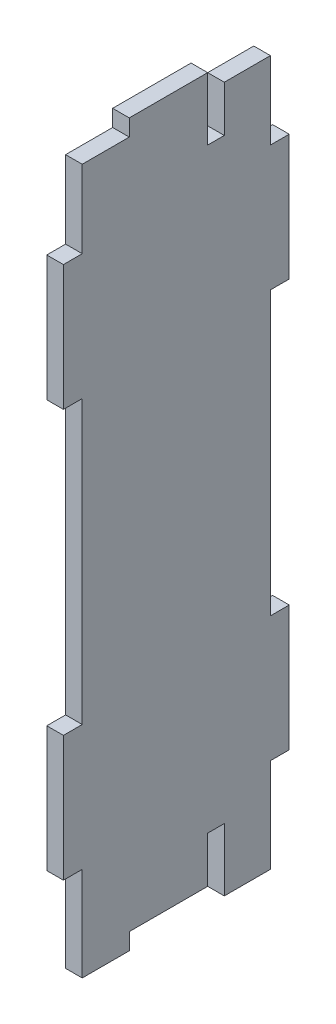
SolidWorks part; units mm, degrees
ref_plane "Alzado" through (0, 0, 0) normal (0, 0, 1) x (1, 0, 0)
ref_plane "Planta" through (0, 0, 0) normal (0, 1, 0) x (1, 0, 0)
ref_plane "Vista lateral" through (0, 0, 0) normal (1, 0, 0) x (0, 0, -1)
sketch "Croquis1" plane through (0, 0, 0) normal (0, 0, 1) x (1, 0, 0)
  line L0 (105, 5) -> (131.2289, 5) construction
  line L1 (120, 5) -> (117.35, 5)
  line L2 (120, 5) -> (120, 120)
  line L3 (120, 120) -> (117.35, 120)
  line L4 (117.35, 5) -> (117.35, 120)
  line L5 (105, 120) -> (131.2289, 120) construction
  line L6 (120, 20) -> (120, 40) construction
  line L7 (117.35, 40) -> (117.35, 20) construction
extrude "Saliente-Extruir2" add sketch "Croquis1" along normal up to surface (30 mm away)
sketch "Croquis2" plane through (120, 0, 0) normal (1, 0, 0) x (0, 0, -1)
  line L0 (-30, 5) -> (0, 5) construction
  line L1 (-22.5, 5) -> (-7.5, 5)
  line L2 (-22.5, 5) -> (-22.5, 7.65)
  line L3 (-22.5, 7.65) -> (-7.5, 7.65)
  line L4 (-7.5, 5) -> (-7.5, 7.65)
  line L5 (-22.5, 7.65) -> (-10, 7.65) construction
  line L6 (-22.5, 7.65) -> (-22.5, 5) construction
  line L9 (-22.5, 117.35) -> (-30, 117.35)
  line L10 (-22.5, 117.35) -> (-22.5, 120)
  line L11 (-22.5, 120) -> (-30, 120)
  line L12 (-30, 117.35) -> (-30, 120)
  line L13 (0, 120) -> (-7.5, 120)
  line L14 (0, 120) -> (0, 117.35)
  line L15 (0, 117.35) -> (-7.5, 117.35)
  line L16 (-7.5, 120) -> (-7.5, 117.35)
extrude "Cortar-Extruir1" cut sketch "Croquis2" against normal up to surface (2.65 mm away)
sketch "Croquis3" plane through (0, 0, 0) normal (0, 0, -1) x (-1, 0, 0)
  line L0 (-120, 105) -> (-117.35, 105) construction
  line L1 (-120, 105) -> (-117.35, 105)
  line L2 (-120, 105) -> (-120, 85)
  line L3 (-120, 85) -> (-117.35, 85)
  line L4 (-117.35, 105) -> (-117.35, 85)
  line L5 (-120, 5) -> (-120, 117.35) construction
  line L6 (-117.35, 117.35) -> (-117.35, 5) construction
  line L7 (-125, 62.5) -> (-148.5249, 62.5) construction
  line L8 (-120, 85) -> (-117.35, 85) construction
  line L9 (-125, 10) -> (-125, 115) construction
  line L10 (-117.35, 20) -> (-117.35, 40)
  line L11 (-120, 40) -> (-117.35, 40)
  line L12 (-120, 20) -> (-120, 40)
  line L13 (-120, 20) -> (-117.35, 20)
extrude "Saliente-Extruir3" add sketch "Croquis3" along normal up to surface (3 mm away)
ref_plane "Plano1" through (0, 0, 15) normal (0, 0, -1) x (-1, 0, 0)
sketch "Croquis4" plane through (0, 0, 30) normal (0, 0, 1) x (1, 0, 0)
  line L0 (120, 85) -> (117.35, 85) construction
  line L1 (117.35, 85) -> (117.35, 105) construction
  line L2 (117.35, 105) -> (120, 105) construction
  line L3 (120, 105) -> (120, 85) construction
  line L4 (117.35, 20) -> (117.35, 40) construction
  line L5 (117.35, 40) -> (120, 40) construction
  line L6 (120, 40) -> (120, 20) construction
  line L7 (120, 20) -> (117.35, 20) construction
  line L8 (120, 85) -> (117.35, 85)
  line L9 (117.35, 85) -> (117.35, 105)
  line L10 (117.35, 105) -> (120, 105)
  line L11 (120, 105) -> (120, 85)
  line L12 (117.35, 20) -> (117.35, 40)
  line L13 (117.35, 40) -> (120, 40)
  line L14 (120, 40) -> (120, 20)
  line L15 (120, 20) -> (117.35, 20)
extrude "Saliente-Extruir4" add sketch "Croquis4" along normal up to surface (3 mm away)
sketch "Croquis5" plane through (120, 0, 0) normal (1, 0, 0) x (0, 0, -1)
  line L0 (-22.5, 120) -> (-7.5, 120) construction
  line L1 (-10, 120) -> (-7.35, 120)
  line L2 (-10, 120) -> (-10, 110)
  line L3 (-10, 110) -> (-7.35, 110)
  line L4 (-7.35, 120) -> (-7.35, 110)
  line L5 (-7.5, 117.35) -> (-7.5, 120) construction
  line L8 (-15, 7.65) -> (-15, 51.6311) construction
  line L9 (-7.5, 7.65) -> (-22.5, 7.65) construction
  line L11 (3, 10) -> (3, 115) construction
  line L12 (0, 62.5) -> (-15, 62.5) construction
  line L13 (0, 40) -> (0, 85) construction
  line L14 (-7.35, 5) -> (-7.35, 15)
  line L15 (-10, 15) -> (-7.35, 15)
  line L16 (-10, 5) -> (-10, 15)
  line L17 (-10, 5) -> (-7.35, 5)
  dimension "D1" = 10
  dimension "D2" = 13
extrude "Cortar-Extruir2" cut sketch "Croquis5" against normal blind 3
